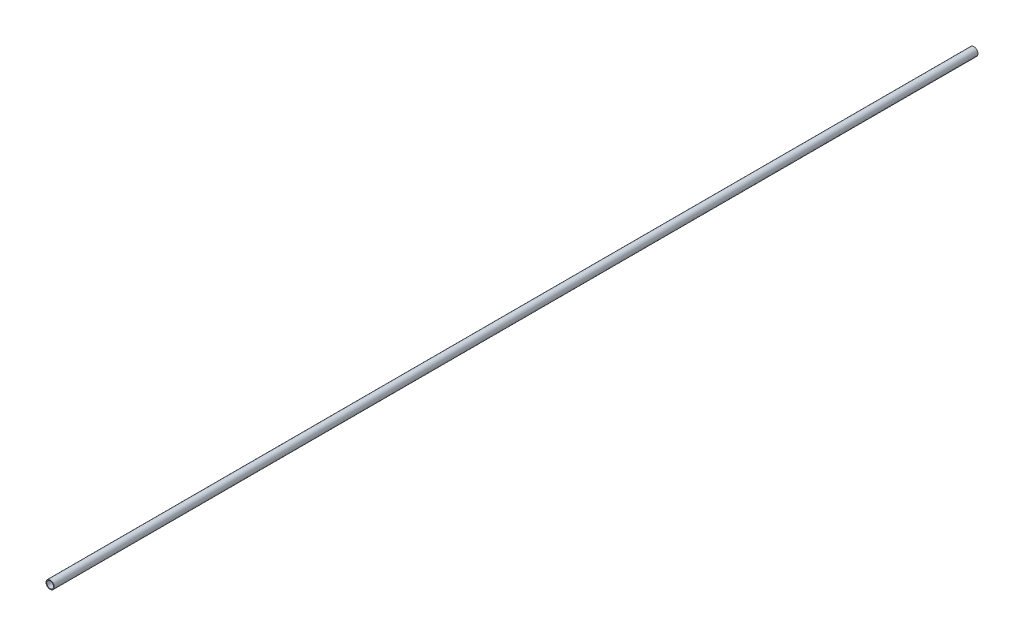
SolidWorks part; units mm, degrees
ref_plane "Alzado" through (0, 0, 0) normal (0, 0, 1) x (1, 0, 0)
ref_plane "Planta" through (0, 0, 0) normal (0, 1, 0) x (1, 0, 0)
ref_plane "Vista lateral" through (0, 0, 0) normal (1, 0, 0) x (0, 0, -1)
sketch "Sketch1" plane through (0, 0, 0) normal (0, 0, 1) x (1, 0, 0)
  circle A0 centre (0, 0) radius 6
  circle A1 centre (0, 0) radius 5
  dimension "D1" = 12
  dimension "D2" = 1
extrude "Boss-Extrude1" add sketch "Sketch1" along normal blind 1350
